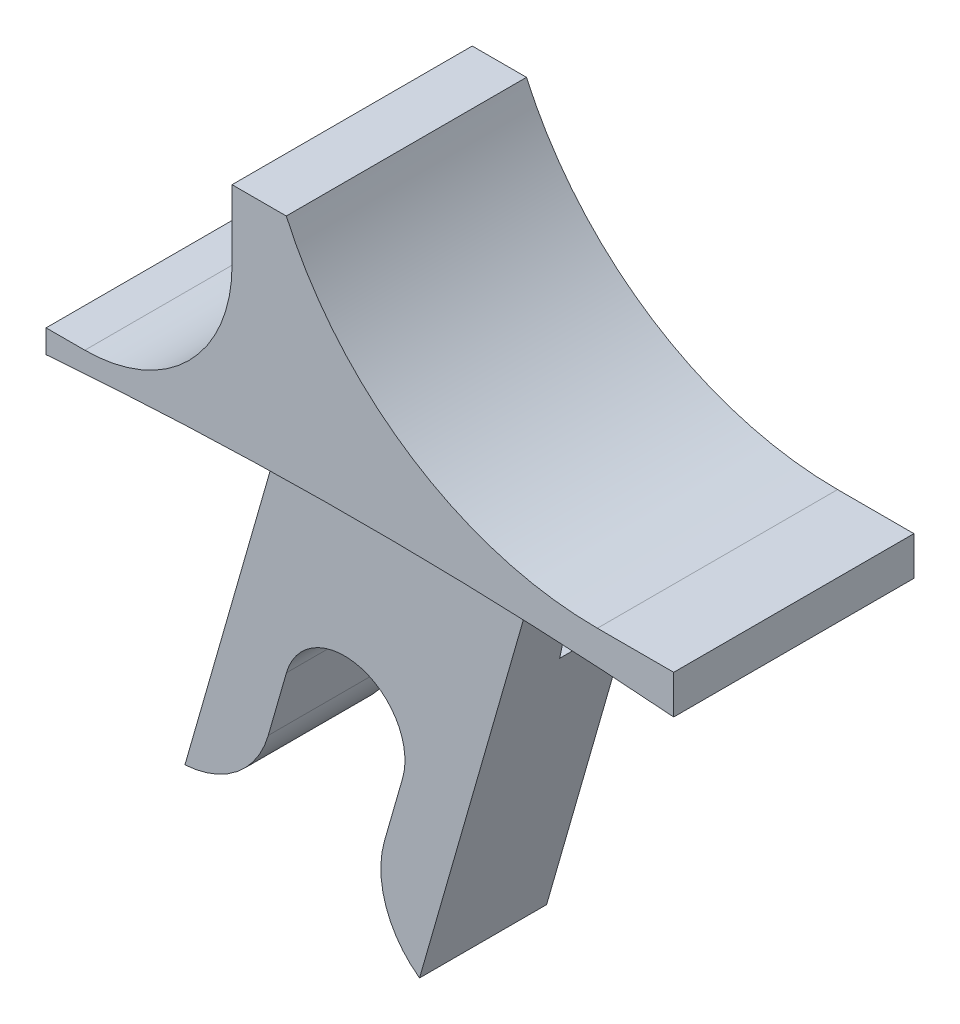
SolidWorks part; units mm, degrees
ref_plane "Front Plane" through (0, 0, 0) normal (0, 0, 1) x (1, 0, 0)
ref_plane "Top Plane" through (0, 0, 0) normal (0, 1, 0) x (1, 0, 0)
ref_plane "Right Plane" through (0, 0, 0) normal (1, 0, 0) x (0, 0, -1)
sketch "Sketch1" plane through (0, 0, 0) normal (0, 0, 1) x (1, 0, 0)
  line L0 (0, 0) -> (-20.574, 0) construction
  line L1 (0, 18.7316) -> (0, 0) construction
  line L2 (0, 0) -> (-32.5499, 0) construction
  line L3 (-12.7, 7.874) -> (-14.478, 7.874)
  line L4 (-14.478, 7.874) -> (-14.478, 5.588)
  line L5 (-19.304, 0.762) -> (-20.574, 0.762)
  line L6 (-20.574, 0.762) -> (-20.574, 0)
  line L7 (0, 0) -> (0, 1.27)
  line L8 (0, 1.27) -> (-2.502, 1.27)
  arc A0 (-14.478, 5.588) -> (-19.304, 0.762) centre (-19.304, 5.588) cw
  arc A1 (-12.7, 7.874) -> (-2.502, 1.27) centre (-2.502, 12.446) ccw
  arc A2 (-20.574, 0) -> (0, 0) centre (-10.287, -130.6597) cw
  dimension "D5" = 4.826
  dimension "D8" = 11.176
  dimension "D9" = 131.064
  dimension "D1" = 20.574
  dimension "D2" = 7.874
  dimension "D3" = 6.096
  dimension "D4" = 0.762
  dimension "D6" = 1.27
  dimension "D7" = 1.778
extrude "Boss-Extrude1" add sketch "Sketch1" along normal mid plane 7.874
sketch "Sketch2" plane through (0, 0, 0) normal (0, 0, 1) x (1, 0, 0)
  line L0 (-6.1373, 0.6911) -> (-10.1861, -13.4288)
  line L4 (-14.4607, 0.6911) -> (-17.8772, -11.2235)
  line L6 (-14.0265, 2.2054) -> (-17.8772, -11.2235) construction
  line L9 (-18.7048, -7.493) -> (-9.454, -7.493) construction
  line L10 (-10.7413, -8.0391) -> (-17.8906, -5.9891) construction
  line L11 (-14.5502, -6.9469) -> (-15.1453, -9.022)
  line L14 (-10.7413, -8.0391) -> (-11.3363, -10.1142)
  line L15 (-6.3355, 0) -> (-10.1861, -13.4288) construction
  line L16 (-14.4607, 0.6911) -> (-6.1373, 0.6911)
  arc A0 (-14.5502, -6.9469) -> (-10.7413, -8.0391) centre (-12.6458, -7.493) cw
  arc A1 (-17.8772, -11.2235) -> (-15.1453, -9.022) centre (-18.0752, -8.1819) ccw
  arc A2 (-10.6646, -7.493) -> (-10.7413, -8.0391) centre (-12.6458, -7.493) cw
  arc A3 (-10.1861, -13.4288) -> (-11.3363, -10.1142) centre (-8.4064, -10.9544) cw
  dimension "D1" = 7.493
extrude "Boss-Extrude2" add sketch "Sketch2" along normal mid plane 4.1656
ref_plane "Plane1" through (0, -2.5146, 0) normal (0, 1, 0) x (1, 0, 0)
sketch "Sketch4" plane through (0, -2.5146, 0) normal (0, 1, 0) x (1, 0, 0)
  line L0 (-2.502, 3.937) -> (-12.7, 3.937) construction
  line L4 (-11.6073, 1.2954) -> (-17.9573, -1.0158)
  line L5 (-17.9573, -1.0158) -> (-17.9573, 2.8194)
  line L6 (-17.9573, 2.8194) -> (-5.2573, 2.8194)
  line L7 (-11.6073, 1.2954) -> (-11.6073, 2.8702) construction
  line L8 (-5.2573, -1.0158) -> (-5.2573, 2.8194)
  line L9 (-11.6073, 1.2954) -> (-5.2573, -1.0158)
  point P14 (-11.6073, 2.8194)
  dimension "D1" = 1.1176
  dimension "D2" = 20
  dimension "D3" = 6.35
  dimension "D4" = 20
  dimension "D5" = 1.524
extrude "Cut-Extrude1" cut sketch "Sketch4" against normal mid plane 2.8194
